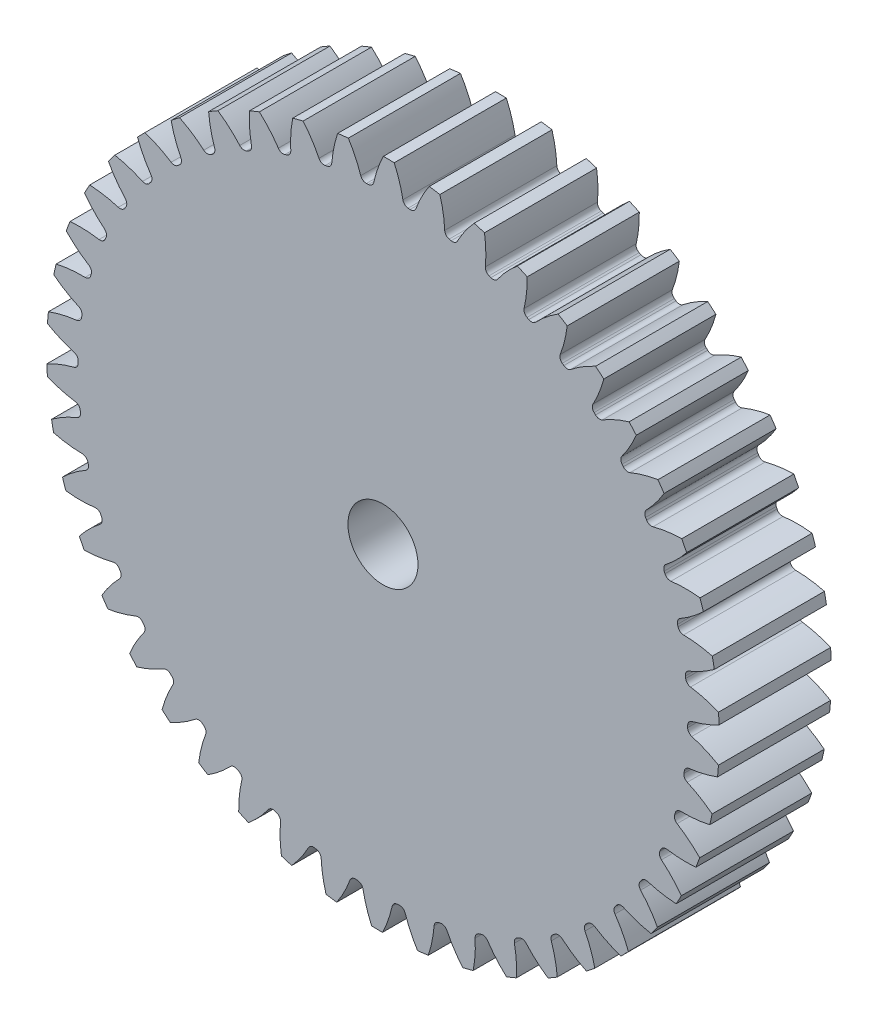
SolidWorks part; units mm, degrees
ref_plane "Front" through (0, 0, 0) normal (0, 0, 1) x (1, 0, 0)
ref_plane "Top" through (0, 0, 0) normal (0, 1, 0) x (1, 0, 0)
ref_plane "Right" through (0, 0, 0) normal (1, 0, 0) x (0, 0, -1)
sketch "Sketch3" plane through (0, 0, 0) normal (0, 0, 1) x (1, 0, 0)
  circle A0 centre (0, 0) radius 304.8
  dimension "od" = 609.6
extrude "gearBody" add sketch "Sketch3" along normal blind 101.6
sketch "Sketch2" plane through (0, 0, 0) normal (0, 0, 1) x (1, 0, 0)
  line L0 (0, 0) -> (253.5903, 105.0406) construction
  line L1 (304.2402, -21.3453) -> (0, 0) construction
  line L2 (0, 0) -> (36.3143, 0) construction
  line L3 (292.06, 4.8362) -> (291.713, -15.031) construction
  line L5 (291.8865, -5.0974) -> (0, 0) construction
  line L7 (0, 0) -> (274.4842, 0) construction
  arc A0 (274.4841, -0.2413) -> (274.3252, -9.3429) centre (0, 0) ccw construction
  arc A1 (304.6153, 10.6092) -> (304.0591, -21.2389) centre (0, 0) ccw construction
  arc A2 (292.06, 4.8362) -> (291.713, -15.031) centre (0, 0) ccw construction
  arc A3 (276.1654, -5.7385) -> (276.1974, -3.9078) centre (0, 0) ccw
  arc A4 (304.2402, -21.3453) -> (279.8829, -10.8071) centre (249.7681, -113.831) ccw
  arc A5 (304.2402, -21.3453) -> (304.8, 10.7092) centre (0, 0) ccw
  arc A6 (304.8, 10.7092) -> (280.0896, 1.028) centre (253.5903, 105.0406) cw
  arc A7 (276.1974, -3.9078) -> (280.0896, 1.028) centre (281.3657, -3.9809) cw
  arc A8 (279.8829, -10.8071) -> (276.1654, -5.7385) centre (281.3332, -5.8459) cw
  point P6 (304.8, 10.7092)
  point P22 (304.2402, -21.3453)
  dimension "baseDia" = 548.9684
  dimension "od" = 609.6
  dimension "pd" = 584.2
  dimension "rd" = 552.45
  dimension "rFillet" = 5.1689
  dimension "pointX" = 304.8
  dimension "pointY" = 10.7092
  dimension "CTT" = 19.8672
  dimension "flankCenterAngle" = 22.5
extrude "toothCut" cut sketch "Sketch2" along normal through all
pattern_circular "CirPattern1" count 46 over 360 about axis through (0, 0, 0) along (0, 0, 1) of "toothCut"
sketch "hub1Dia" plane through (0, 0, 0) normal (0, 0, -1) x (-1, 0, 0)
  circle A0 centre (0, 0) radius 12.7
  dimension "hub1Dia" = 25.4
sketch "hub2Dia" plane through (0, 0, 101.6) normal (0, 0, 1) x (1, 0, 0)
  circle A0 centre (0, 0) radius 12.7
  dimension "hub2dia" = 25.4
sketch "boreDia" plane through (0, 0, 0) normal (0, 0, 1) x (1, 0, 0)
  circle A0 centre (0, 0) radius 31.75
  dimension "boreDia" = 63.5
extrude "bore" cut sketch "boreDia" against normal mid plane 25400
